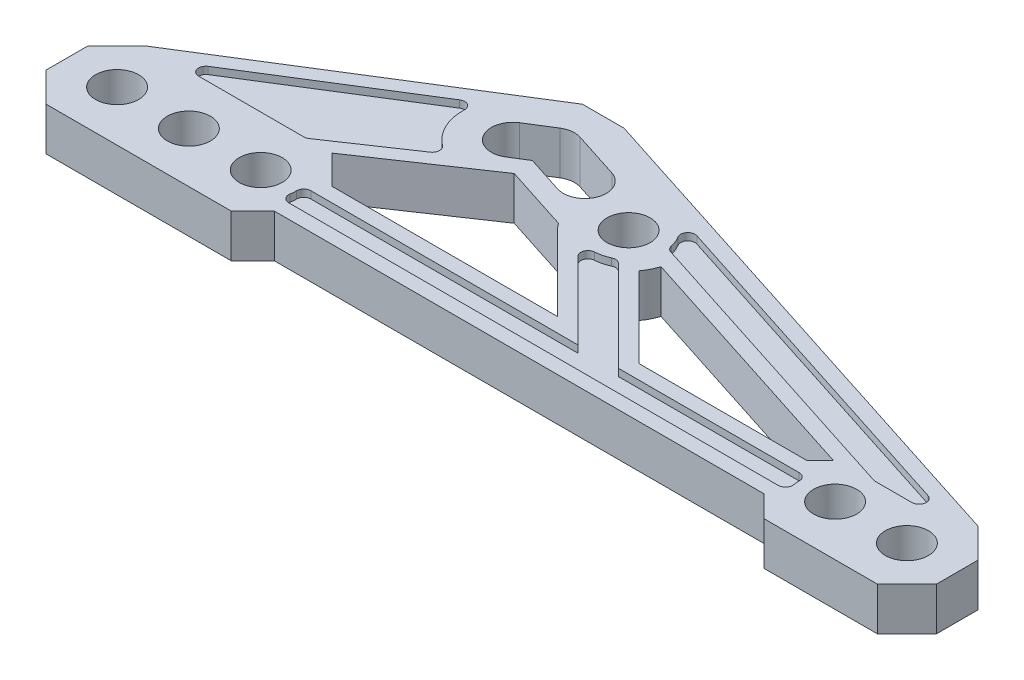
SolidWorks part; units mm, degrees
ref_plane "Front" through (0, 0, 0) normal (0, 0, 1) x (1, 0, 0)
ref_plane "Top" through (0, 0, 0) normal (0, 1, 0) x (1, 0, 0)
ref_plane "Right" through (0, 0, 0) normal (1, 0, 0) x (0, 0, -1)
sketch "Esquisse1" plane through (0, 0, 0) normal (0, 1, 0) x (1, 0, 0)
  line L0 (0, 0) -> (18.6816, 11.6735) construction
  line L1 (18.6816, 11.6735) -> (55, 0) construction
  line L2 (16.961, 10.5984) -> (18.6816, 11.6735) construction
  line L3 (16.1661, 11.8705) -> (17.8867, 12.9456)
  line L4 (17.7558, 9.3263) -> (19.4764, 10.4015)
  line L5 (18.6816, 11.6735) -> (21.9444, 10.6248) construction
  line L6 (19.1406, 13.1016) -> (22.4034, 12.0528)
  line L7 (18.2226, 10.2455) -> (21.4854, 9.1967)
  line L8 (14.6567, -2) -> (43.0913, -2)
  line L40 (1.4497, 3.5) -> (-1.4497, 3.5)
  line L41 (-1.4497, 3.5) -> (-3.5, 1.4497)
  line L42 (-3.5, 1.4497) -> (-3.5, -1.4497)
  line L43 (-3.5, -1.4497) -> (-1.4497, -3.5)
  line L44 (-1.4497, -3.5) -> (1.4497, -3.5)
  line L45 (1.4497, -3.5) -> (3.5, -1.4497)
  line L46 (3.5, -1.4497) -> (3.5, 1.4497)
  line L47 (3.5, 1.4497) -> (1.4497, 3.5)
  line L48 (8.5503, -3.5) -> (11.4497, -3.5)
  line L49 (11.4497, -3.5) -> (13.5, -1.4497)
  line L50 (13.5, -1.4497) -> (13.5, 1.4497)
  line L51 (13.5, 1.4497) -> (11.4497, 3.5)
  line L52 (11.4497, 3.5) -> (8.5503, 3.5)
  line L53 (8.5503, 3.5) -> (6.5, 1.4497)
  line L54 (6.5, 1.4497) -> (6.5, -1.4497)
  line L55 (6.5, -1.4497) -> (8.5503, -3.5)
  line L56 (48.5503, -3.5) -> (51.4497, -3.5)
  line L57 (51.4497, -3.5) -> (53.5, -1.4497)
  line L58 (53.5, -1.4497) -> (53.5, 1.4497)
  line L59 (53.5, 1.4497) -> (51.4497, 3.5)
  line L60 (51.4497, 3.5) -> (48.5503, 3.5)
  line L61 (48.5503, 3.5) -> (46.5, 1.4497)
  line L62 (46.5, 1.4497) -> (46.5, -1.4497)
  line L63 (46.5, -1.4497) -> (48.5503, -3.5)
  line L64 (56.4497, -3.5) -> (58.5, -1.4497)
  line L65 (58.5, -1.4497) -> (58.5, 1.4497)
  line L66 (58.5, 1.4497) -> (56.4497, 3.5)
  line L67 (56.4497, 3.5) -> (53.5503, 3.5)
  line L68 (53.5503, 3.5) -> (51.5, 1.4497)
  line L69 (51.5, 1.4497) -> (51.5, -1.4497)
  line L70 (51.5, -1.4497) -> (53.5503, -3.5)
  line L71 (53.5503, -3.5) -> (56.4497, -3.5)
  line L72 (17.2318, 15.1735) -> (15.1816, 13.1233)
  line L73 (15.1816, 13.1233) -> (15.1816, 10.2238)
  line L74 (15.1816, 10.2238) -> (17.2318, 8.1735)
  line L75 (17.2318, 8.1735) -> (20.1313, 8.1735)
  line L76 (20.1313, 8.1735) -> (22.1816, 10.2238)
  line L77 (22.1816, 10.2238) -> (22.1816, 13.1233)
  line L78 (22.1816, 13.1233) -> (20.1313, 15.1735)
  line L79 (20.1313, 15.1735) -> (17.2318, 15.1735)
  circle A0 centre (0, 0) radius 3.5
  circle A1 centre (0, 0) radius 1.5
  circle A2 centre (5, 0) radius 1.5
  circle A3 centre (10, 0) radius 1.5
  circle A4 centre (50, 0) radius 1.5
  circle A5 centre (55, 0) radius 1.5
  arc A6 (16.1661, 11.8705) -> (17.7558, 9.3263) centre (16.961, 10.5984) ccw
  arc A7 (19.4764, 10.4015) -> (17.8867, 12.9456) centre (18.6816, 11.6735) ccw
  arc A8 (19.1406, 13.1016) -> (18.2226, 10.2455) centre (18.6816, 11.6735) ccw
  arc A9 (21.4854, 9.1967) -> (22.4034, 12.0528) centre (21.9444, 10.6248) ccw
  circle A10 centre (26.4391, 9.1801) radius 1.5
  circle A12 centre (0, 0) radius 3.5 construction
  circle A13 centre (10, 0) radius 3.5 construction
  circle A14 centre (50, 0) radius 3.5 construction
  circle A15 centre (55, 0) radius 3.5 construction
  circle A16 centre (18.6816, 11.6735) radius 3.5 construction
  point P13 (17.8213, 11.136)
  point P21 (20.313, 11.1492)
  dimension "D1" = 7
  dimension "D2" = 3
  dimension "D4" = 10
  dimension "D5" = 50
  dimension "D3" = 5
  dimension "D6" = 5
  dimension "D7" = 20
  dimension "D8" = 30
  dimension "D9" = 20
  dimension "D10" = 30
  dimension "D11" = 32
  dimension "D12" = 2
sketch "Esquisse2" plane through (0, 0, 0) normal (0, 1, 0) x (1, 0, 0)
  line L0 (34.8263, 1.5) -> (46.5503, 1.5)
  line L1 (16.1661, 11.8705) -> (17.8867, 12.9456) construction
  line L3 (20.1313, 15.1735) -> (17.2318, 15.1735)
  line L4 (20.1313, 15.1735) -> (56.4497, 3.5)
  line L5 (56.4497, 3.5) -> (58.5, 1.4497)
  line L6 (58.5, 1.4497) -> (58.5, -1.4497)
  line L7 (58.5, -1.4497) -> (56.4497, -3.5)
  line L8 (56.4497, -3.5) -> (48.5503, -3.5)
  line L9 (48.5503, -3.5) -> (47.0503, -2)
  line L11 (11.4497, -3.5) -> (12.9497, -2)
  line L12 (14.6567, -2) -> (43.0913, -2) construction
  line L13 (12.9497, -2) -> (47.0503, -2)
  line L14 (11.4497, -3.5) -> (-1.4497, -3.5)
  line L17 (-1.4497, 3.5) -> (17.2318, 15.1735)
  line L18 (17.7558, 9.3263) -> (19.4764, 10.4015) construction
  line L19 (16.1661, 11.8705) -> (17.8867, 12.9456)
  line L20 (17.7558, 9.3263) -> (18.8857, 10.0323)
  line L21 (18.2226, 10.2455) -> (21.4854, 9.1967) construction
  line L22 (19.1406, 13.1016) -> (22.4034, 12.0528) construction
  line L23 (19.1406, 13.1016) -> (22.4034, 12.0528)
  line L24 (18.8857, 10.0323) -> (21.4854, 9.1967)
  line L25 (11.4497, 3.5) -> (19.0385, 8.6177)
  line L26 (13.4497, 1.5) -> (29.1694, 1.5)
  line L27 (18.6816, 11.6735) -> (55, 0) construction
  line L29 (47.4704, 2.4202) -> (46.5503, 1.5)
  line L31 (13.4497, 1.5) -> (11.4497, 3.5)
  line L32 (29.7712, 8.1091) -> (47.4704, 2.4202)
  line L33 (23.583, 7.157) -> (19.0385, 8.6177)
  line L34 (23.9642, 6.7052) -> (29.1694, 1.5)
  line L35 (29.2421, 7.0842) -> (34.8263, 1.5)
  line L36 (26.7926, 9.5337) -> (31.9979, 4.3284) construction
  line L37 (-1.4497, 3.5) -> (-3.5, 1.4497) construction
  line L38 (-3.5, 1.4497) -> (-3.5, -1.4497) construction
  line L39 (-3.5, -1.4497) -> (-1.4497, -3.5) construction
  line L40 (-1.4497, 3.5) -> (-3.5, 1.4497)
  line L41 (-3.5, 1.4497) -> (-3.5, -1.4497)
  line L42 (-3.5, -1.4497) -> (-1.4497, -3.5)
  line L43 (11.4497, -3.5) -> (13.5, -1.4497) construction
  line L44 (46.5, -1.4497) -> (48.5503, -3.5) construction
  line L45 (56.4497, -3.5) -> (58.5, -1.4497) construction
  line L46 (53.5503, -3.5) -> (56.4497, -3.5) construction
  line L47 (58.5, -1.4497) -> (58.5, 1.4497) construction
  line L48 (58.5, 1.4497) -> (56.4497, 3.5) construction
  line L49 (20.1313, 15.1735) -> (17.2318, 15.1735) construction
  line L50 (13.5, 1.4497) -> (11.4497, 3.5) construction
  line L51 (48.5503, 3.5) -> (46.5, 1.4497) construction
  circle A0 centre (0, 0) radius 1.5 construction
  circle A1 centre (0, 0) radius 1.5
  circle A2 centre (5, 0) radius 1.5 construction
  circle A3 centre (5, 0) radius 1.5
  circle A4 centre (10, 0) radius 1.5 construction
  circle A5 centre (10, 0) radius 1.5
  arc A6 (19.4764, 10.4015) -> (17.8867, 12.9456) centre (18.6816, 11.6735) ccw construction
  arc A7 (16.1661, 11.8705) -> (17.7558, 9.3263) centre (16.961, 10.5984) ccw construction
  arc A8 (19.1406, 13.1016) -> (17.8867, 12.9456) centre (18.6816, 11.6735) ccw
  arc A9 (16.1661, 11.8705) -> (17.7558, 9.3263) centre (16.961, 10.5984) ccw
  arc A10 (21.4854, 9.1967) -> (22.4034, 12.0528) centre (21.9444, 10.6248) ccw construction
  arc A11 (21.4854, 9.1967) -> (22.4034, 12.0528) centre (21.9444, 10.6248) ccw
  circle A12 centre (26.4391, 9.1801) radius 1.5 construction
  circle A13 centre (26.4391, 9.1801) radius 1.5
  circle A14 centre (50, 0) radius 1.5 construction
  circle A15 centre (50, 0) radius 1.5
  circle A16 centre (55, 0) radius 1.5 construction
  circle A17 centre (55, 0) radius 1.5
  circle A18 centre (0, 0) radius 3.5 construction
  arc A20 (23.583, 7.157) -> (23.9642, 6.7052) centre (26.4391, 9.1801) ccw
  arc A21 (29.2421, 7.0842) -> (29.7712, 8.1091) centre (26.4391, 9.1801) ccw
  point P1 (-1.2541, -3.5)
  point P64 (-1.3179, 3.2424)
  point P66 (6.478, -4.6175)
  point P69 (11.4497, 3.5)
  point P80 (11.6138, -3.3359)
  point P83 (49.0624, -3.5146)
  point P92 (56.4497, 3.5)
  point P96 (17.2318, 15.1735)
  point P98 (20.1313, 15.1735)
  dimension "D2" = 45
  dimension "D3" = 1.3
  dimension "D1" = 4
extrude "Boss.-Extru.1" add sketch "Esquisse2" along normal mid plane 3
sketch "Esquisse3" plane through (0, 0, 0) normal (0, 1, 0) x (1, 0, 0)
  line L0 (2.181, 3.5) -> (9.5084, 3.5)
  line L1 (50.189, 2.6219) -> (52.724, 2.6219)
  line L16 (-0.8232, 2.7123) -> (-2.5, 1.0355)
  line L18 (-2.5, 1.0355) -> (-2.5, -1.0355)
  line L20 (-2.5, -1.0355) -> (-1.0355, -2.5)
  line L25 (9.8848, 3.6508) -> (13.0355, 0.5)
  line L26 (17.5186, 14.1735) -> (-0.8232, 2.7123)
  line L29 (-1.0355, -2.5) -> (11.0355, -2.5)
  line L30 (11.0355, -2.5) -> (12.5355, -1)
  line L31 (12.5355, -1) -> (47.4645, -1)
  line L32 (47.4645, -1) -> (48.9645, -2.5)
  line L33 (48.9645, -2.5) -> (56.0355, -2.5)
  line L34 (56.0355, -2.5) -> (57.5, -1.0355)
  line L35 (57.5, -1.0355) -> (57.5, 1.0355)
  line L36 (57.5, 1.0355) -> (55.9136, 2.6219)
  line L37 (55.9136, 2.6219) -> (19.9745, 14.1735)
  line L38 (19.9745, 14.1735) -> (17.5186, 14.1735)
  line L39 (12.6984, 11.1616) -> (1.9161, 4.424)
  line L44 (12.958, -1) -> (47.042, -1)
  line L50 (52.877, 3.598) -> (29.1494, 11.2245)
  line L52 (18.8821, 9.7184) -> (9.8848, 3.6508)
  line L53 (24.2366, 7.9973) -> (18.8821, 9.7184)
  line L54 (31.5836, 0.5) -> (24.6713, 7.4123)
  line L55 (13.0355, 0.5) -> (31.5836, 0.5)
  line L57 (14.8342, 6.9886) -> (9.7879, 3.5855)
  line L59 (31.5836, 0.5) -> (26.2525, 5.8312)
  line L60 (13, 0.5) -> (31.5836, 0.5)
  line L65 (46.9645, 0.5) -> (49.3355, 2.8711)
  line L66 (34.4121, 0.5) -> (46.9645, 0.5)
  line L67 (27.8176, 7.0945) -> (34.4121, 0.5)
  line L68 (49.3355, 2.8711) -> (28.9265, 9.431)
  line L70 (34.4121, 0.5) -> (47, 0.5)
  line L71 (28.0855, 6.8265) -> (34.4121, 0.5)
  line L72 (50.036, 2.6459) -> (29.2185, 9.3371)
  arc A0 (13.4631, 10.7202) -> (14.8554, 7.8025) centre (16.961, 10.5984) ccw
  arc A1 (12.5, 0) -> (12.465, -0.4167) centre (10, 0) cw
  arc A2 (24.2366, 7.9973) -> (24.6713, 7.4123) centre (26.4391, 9.1801) ccw
  arc A4 (26.5782, 6.684) -> (26.2525, 5.8312) centre (26.606, 6.1847) ccw
  arc A5 (27.8176, 7.0945) -> (28.9265, 9.431) centre (26.4391, 9.1801) ccw
  arc A6 (26.5782, 6.684) -> (27.5165, 6.9242) centre (26.4391, 9.1801) ccw
  arc A7 (47.5, 0) -> (47.535, -0.4167) centre (50, 0) ccw
  arc A10 (28.8828, 9.7076) -> (28.5702, 10.4871) centre (26.4391, 9.1801) ccw
  arc A11 (28.0855, 6.8265) -> (27.5165, 6.9242) centre (27.732, 6.473) ccw
  arc A12 (28.8828, 9.7076) -> (29.2185, 9.3371) centre (29.3715, 9.8131) ccw
  arc A13 (28.5702, 10.4871) -> (29.1494, 11.2245) centre (28.9964, 10.7485) cw
  arc A14 (14.8554, 7.8025) -> (14.8342, 6.9886) centre (14.5547, 7.4031) cw
  arc A15 (13.4631, 10.7202) -> (12.6984, 11.1616) centre (12.9634, 10.7376) ccw
  arc A16 (2.181, 3.5) -> (1.9161, 4.424) centre (2.181, 4) cw
  arc A17 (9.5084, 3.5) -> (9.7879, 3.5855) centre (9.5084, 4) ccw
  arc A18 (12.465, -0.4167) -> (12.958, -1) centre (12.958, -0.5) ccw
  arc A19 (12.5, 0) -> (13, 0.5) centre (13, 0) cw
  arc A20 (52.724, 2.6219) -> (52.877, 3.598) centre (52.724, 3.1219) ccw
  arc A21 (50.189, 2.6219) -> (50.036, 2.6459) centre (50.189, 3.1219) cw
  arc A22 (47.042, -1) -> (47.535, -0.4167) centre (47.042, -0.5) ccw
  arc A23 (47, 0.5) -> (47.5, 0) centre (47, 0) cw
  dimension "D4" = 3.5
  dimension "D5" = 0.5
  dimension "D6" = 0.5
  dimension "D7" = 0.5
  dimension "D8" = 0.5
  dimension "D9" = 0.5
  dimension "D10" = 0.5
  dimension "D1" = 1
  dimension "D2" = 1
  dimension "D3" = 1
extrude "Enlèv. mat.-Extru.1" cut sketch "Esquisse3" against normal through all from offset 1
mirror "Symétrie1" about plane through (0, 0, 0) normal (0, 1, 0) of "Enlèv. mat.-Extru.1"
